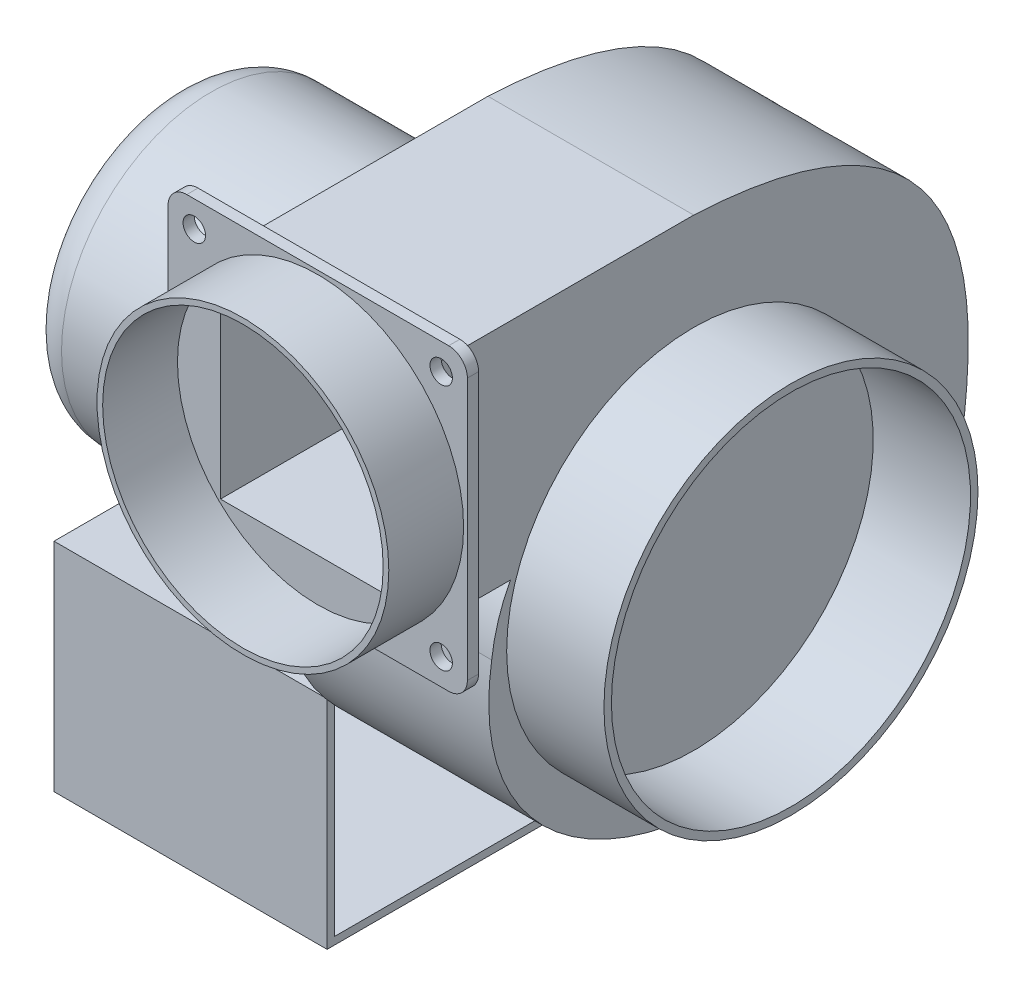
SolidWorks part; units mm, degrees
ref_plane "前视基准面" through (0, 0, 0) normal (0, 0, 1) x (1, 0, 0)
ref_plane "上视基准面" through (0, 0, 0) normal (0, 1, 0) x (1, 0, 0)
ref_plane "右视基准面" through (0, 0, 0) normal (1, 0, 0) x (0, 0, -1)
sketch "草图1" plane through (0, 0, 0) normal (1, 0, 0) x (0, 0, -1)
  line L3 (0, 76) -> (-70, 76)
  line L4 (-70, 16) -> (-49, 16)
  line L5 (-70, 76) -> (-70, 16)
  spline S0 degree 3 poles (-54, 0) (-66.1253, -77.1585) (67.4224, -91.4046) (73, 0) knots 0 0 0 0 1 1 1 1
  spline S1 degree 2 poles (73, 0) (78.9592, 72.2823) (0, 76) knots 0 0 0 1 1 1
  spline S2 degree 2 poles (-54, 0) (-53.036, 8.4546) (-49, 16) knots 0 0 0 1 1 1
extrude "凸台-拉伸1" add sketch "草图1" along normal blind 55
sketch "草图2" plane through (0, 0, 70) normal (0, 0, 1) x (1, 0, 0)
  line L4 (-7.5, 6) -> (62.5, 6)
  line L5 (-12.5, 11) -> (-12.5, 81)
  line L6 (-7.5, 86) -> (62.5, 86)
  line L7 (67.5, 11) -> (67.5, 81)
  line L8 (-12.5, 6) -> (67.5, 86) construction
  line L9 (-12.5, 86) -> (67.5, 6) construction
  arc A0 (-12.5, 81) -> (-7.5, 86) centre (-7.5, 81) cw
  arc A1 (-7.5, 6) -> (-12.5, 11) centre (-7.5, 11) cw
  arc A2 (62.5, 6) -> (67.5, 11) centre (62.5, 11) ccw
  arc A3 (62.5, 86) -> (67.5, 81) centre (62.5, 81) cw
  point P6 (27.5, 46)
  dimension "D1" = 5
extrude "凸台-拉伸2" add sketch "草图2" along normal blind 3
sketch "草图3" plane through (0, 0, 73) normal (0, 0, 1) x (1, 0, 0)
  circle A0 centre (-5.5, 79) radius 3
  circle A1 centre (60.5, 79) radius 3
  circle A2 centre (60.5, 13) radius 3
  circle A3 centre (-5.5, 13) radius 3
  point P6 (27.5, 46)
extrude "切除-拉伸1" cut sketch "草图3" against normal blind 3
sketch "草图4" plane through (0, 0, 73) normal (0, 0, 1) x (1, 0, 0)
  line L4 (1.5, 20) -> (53.5, 20)
  line L5 (1.5, 20) -> (1.5, 72)
  line L6 (1.5, 72) -> (53.5, 72)
  line L7 (53.5, 20) -> (53.5, 72)
  line L8 (1.5, 20) -> (53.5, 72) construction
  line L9 (1.5, 72) -> (53.5, 20) construction
  point P6 (27.5, 46)
extrude "切除-拉伸2" cut sketch "草图4" against normal blind 70
sketch "草图5" plane through (0, 0, 73) normal (0, 0, 1) x (1, 0, 0)
  circle A0 centre (27.5, 46) radius 39
  circle A1 centre (27.5, 46) radius 37.5
extrude "凸台-拉伸3" add sketch "草图5" along normal blind 20 separate body
sketch "草图6" plane through (55, 0, 0) normal (1, 0, 0) x (0, 0, -1)
  circle A0 centre (0, 0) radius 50
  circle A1 centre (0, 0) radius 48
extrude "凸台-拉伸4" add sketch "草图6" along normal blind 26 separate body
sketch "草图8" plane through (0, 0, 0) normal (-1, 0, 0) x (0, 0, 1)
  circle A0 centre (0, 0) radius 40
extrude "凸台-拉伸5" add sketch "草图8" along normal blind 84
fillet "圆角1" radius 10 1 edges at (-84, 0, 40)
sketch "草图11" plane through (0, 0, 0) normal (-1, 0, 0) x (0, 0, 1)
  line L0 (-43, -100) -> (43, -100)
  line L1 (-41, -98) -> (41, -98)
  line L2 (-43, -42) -> (43, -42)
  line L3 (-43, -42) -> (-43, -100)
  line L5 (-41, -98) -> (-41, -44)
  line L6 (-41, -44) -> (41, -44)
  line L7 (43, -42) -> (43, -100)
  line L9 (41, -98) -> (41, -44)
extrude "凸台-拉伸6" add sketch "草图11" along normal blind 73 separate body
sketch "草图12" plane through (0, -100, 0) normal (0, -1, 0) x (1, 0, 0)
  circle A0 centre (-53, 27.5) radius 3
  circle A1 centre (-20, 27.5) radius 3
  circle A2 centre (-20, -27.5) radius 3
  circle A3 centre (-53, -27.5) radius 3
extrude "切除-拉伸3" cut sketch "草图12" against normal blind 2
